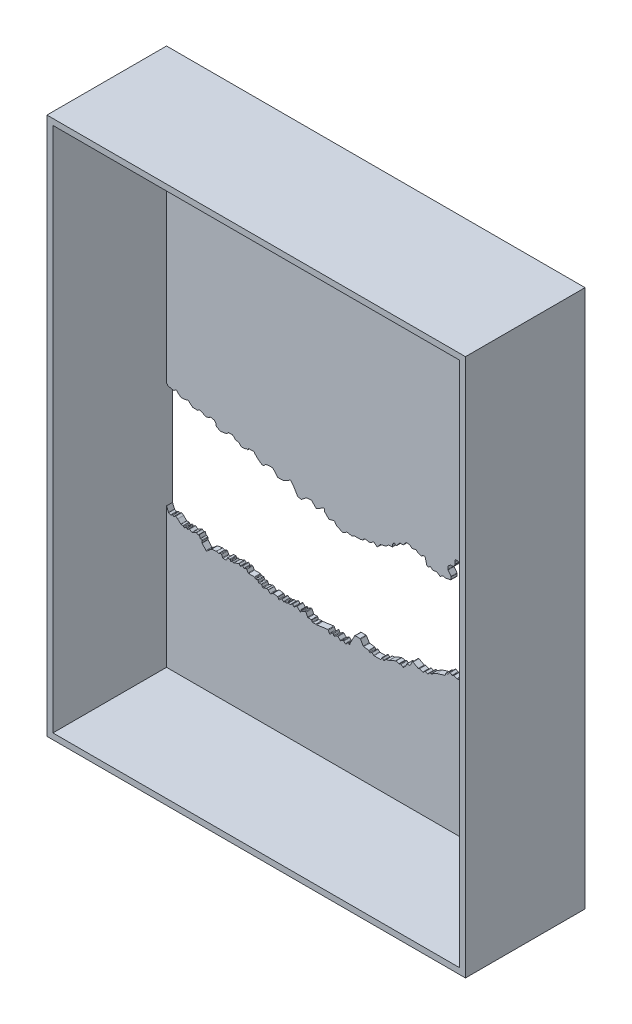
SolidWorks part; units mm, degrees
ref_plane "Plan de face" through (0, 0, 0) normal (0, 0, 1) x (1, 0, 0)
ref_plane "Plan de dessus" through (0, 0, 0) normal (0, 1, 0) x (1, 0, 0)
ref_plane "Plan de droite" through (0, 0, 0) normal (1, 0, 0) x (0, 0, -1)
sketch "Esquisse2" plane through (0, 0, 0) normal (0, 0, 1) x (1, 0, 0)
  line L1 (-700, -900) -> (700, -900)
  line L2 (-700, -900) -> (-700, 900)
  line L3 (-700, 900) -> (700, 900)
  line L4 (700, -900) -> (700, 900)
  line L5 (-700, -900) -> (700, 900) construction
  line L6 (-700, 900) -> (700, -900) construction
  point P0 (0, 0)
  dimension "D1" = 1400
  dimension "D2" = 1800
extrude "Boss.-Extru.2" add sketch "Esquisse2" along normal mid plane 400
shell "Coque1" thickness 20
sketch "Esquisse3" plane through (0, 0, -200) normal (0, 0, -1) x (-1, 0, 0)
  line L0 (-680, -103.7148) -> (-680, -442.1526)
  line L1 (680, -57.3161) -> (680, -412.1299)
  line L2 (-700, -900) -> (-700, 900) construction
  line L3 (700, 900) -> (700, -900) construction
  line L4 (-680, -103.7148) -> (-654.5429, -114.7682)
  line L5 (-571.1489, -108.8852) -> (-562.3972, -114.4682)
  line L6 (-560.2481, -114.5045) -> (-551.366, -109.2518)
  line L7 (-582.8883, -114.5204) -> (-573.298, -108.8489)
  line L8 (-506.7255, -126.8592) -> (-495.7181, -129.6027)
  line L9 (-494.6752, -130.2364) -> (-490.8979, -134.5174)
  line L10 (-394.3767, -118.0774) -> (-390.4085, -120.9941)
  line L11 (-400.3667, -119.7797) -> (-396.4939, -117.8871)
  line L12 (-388.8827, -121.3693) -> (-382.4669, -120.3894)
  line L13 (-358.7974, -71.7411) -> (-351.5781, -70.2973)
  line L14 (59.9419, -189.6992) -> (75.24, -186.5564)
  line L15 (76.6604, -186.7785) -> (89.855, -194.2083)
  line L16 (-350.3579, -70.4273) -> (-337.4728, -76.0219)
  line L17 (-336.2526, -76.1519) -> (-326.9595, -74.2933)
  line L18 (-54.181, -161.718) -> (-35.3279, -166.6844)
  line L19 (-34.2404, -167.3965) -> (-26.0797, -177.7202)
  line L20 (-23.1962, -178.0576) -> (-14.341, -171.0579)
  line L21 (-11.9292, -170.9603) -> (-0.7128, -178.4379)
  line L22 (0.8391, -178.7407) -> (12.6631, -176.3116)
  line L23 (91.7458, -194.2725) -> (112.1043, -184.5649)
  line L24 (113.0095, -183.7192) -> (117.4097, -175.9048)
  line L25 (-270.0973, -151.0215) -> (-254.4318, -154.7954)
  line L26 (119.7215, -174.9269) -> (135.5622, -179.0998)
  line L27 (137.5529, -178.55) -> (151.0177, -164.7823)
  line L28 (151.6029, -163.3469) -> (151.6029, -157.3846)
  line L29 (154.689, -155.6106) -> (168.9714, -163.9283)
  line L30 (168.9714, -163.9283) -> (177.7168, -169.0214)
  line L31 (180.2176, -168.6828) -> (188.9423, -159.7619)
  line L32 (188.9423, -159.7619) -> (193.0823, -154.5842)
  line L33 (194.6857, -153.8134) -> (206.4382, -153.8134)
  line L34 (206.4382, -153.8134) -> (211.7402, -154.8063)
  line L35 (212.6444, -155.2207) -> (228.3905, -167.8113)
  line L36 (230.0918, -168.2176) -> (240.4975, -166.0468)
  line L37 (241.8522, -165.0703) -> (252.6886, -146.463)
  line L38 (252.6886, -146.463) -> (255.7463, -141.2127)
  line L39 (255.7463, -141.2127) -> (264.1303, -130.7273)
  line L40 (267.0158, -130.406) -> (272.7768, -135.0125)
  line L41 (273.1982, -135.2729) -> (291.7269, -143.8294)
  line L42 (291.7269, -143.8294) -> (291.7375, -143.8378)
  line L43 (291.7375, -143.8378) -> (302.2614, -143.8378)
  line L44 (-652.819, -114.7272) -> (-638.9796, -107.9184)
  line L45 (-636.2313, -108.8541) -> (-633.6996, -113.9999)
  line L46 (-631.8576, -115.1466) -> (-623.2296, -115.1466)
  line L47 (-621.778, -114.5453) -> (-611.5488, -104.3161)
  line L48 (-610.0971, -103.7148) -> (-600.7213, -103.7148)
  line L49 (-599.2696, -104.3161) -> (-595.5538, -108.0319)
  line L50 (-595.1674, -108.3352) -> (-584.9986, -114.5083)
  line L51 (-548.554, -109.9739) -> (-542.1719, -120.7657)
  line L52 (-540.9154, -121.7092) -> (-529.6501, -124.6017)
  line L53 (-528.3936, -125.5452) -> (-524.2993, -132.4685)
  line L54 (-522.5322, -133.4764) -> (-515.6008, -133.4764)
  line L55 (-514.1491, -132.8752) -> (-508.6736, -127.3996)
  line L56 (-488.9077, -135.1619) -> (-481.6506, -133.5285)
  line L57 (-481.206, -133.373) -> (-474.6103, -130.1762)
  line L58 (-473.5137, -128.8253) -> (-472.0621, -123.0011)
  line L59 (-470.9655, -121.6502) -> (-468.8396, -120.6198)
  line L60 (-467.271, -120.5277) -> (-457.9632, -123.7583)
  line L61 (-381.5038, -119.9705) -> (-376.718, -116.1875)
  line L62 (-455.5465, -122.9026) -> (-451.5922, -116.5404)
  line L63 (-449.1755, -115.6847) -> (-444.8973, -117.1696)
  line L64 (-442.8659, -116.7695) -> (-437.6627, -112.1785)
  line L65 (-434.7651, -112.3596) -> (-433.7617, -113.4968)
  line L66 (-432.2223, -114.1914) -> (-431.5133, -114.1914)
  line L67 (-430.6179, -113.9859) -> (-423.6899, -110.628)
  line L68 (-421.7108, -110.7317) -> (-417.7507, -113.1931)
  line L69 (-417.295, -113.5784) -> (-414.2023, -117.0835)
  line L70 (-413.1594, -117.7172) -> (-404.1052, -119.9739)
  line L71 (-403.5678, -120.0344) -> (-401.2272, -119.9878)
  line L72 (-376.718, -116.1875) -> (-373.2721, -113.4636)
  line L73 (-372.4923, -111.8531) -> (-372.4923, -109.065)
  line L74 (-370.4394, -107.0121) -> (-370.385, -107.0121)
  line L75 (-370.385, -107.0121) -> (-365.704, -103.3119)
  line L76 (-364.9918, -102.2243) -> (-363.7477, -97.5015)
  line L77 (-364.1224, -95.7055) -> (-366.5109, -92.6839)
  line L78 (-366.5109, -92.6839) -> (-368.8508, -89.7238)
  line L79 (-368.8944, -87.2349) -> (-368.1661, -86.244)
  line L80 (-365.8578, -85.1433) -> (-368.1661, -86.244)
  line L81 (-364.7562, -83.8132) -> (-363.729, -79.9136)
  line L82 (-362.6274, -78.5835) -> (-361.7793, -78.1792)
  line L83 (-360.6137, -76.4495) -> (-360.444, -73.6308)
  line L84 (-325.341, -74.6522) -> (-320.6499, -78.1002)
  line L85 (-312.7291, -77.0942) -> (-308.5398, -85.8799)
  line L86 (-306.3768, -87.0257) -> (-288.1651, -84.2442)
  line L87 (-285.8258, -85.9636) -> (-284.7994, -92.6839)
  line L88 (-284.7994, -92.6839) -> (-284.7994, -99.234)
  line L89 (-284.5995, -100.1176) -> (-281.7217, -106.1529)
  line L90 (-280.3916, -107.2545) -> (-274.4935, -108.8083)
  line L91 (-273.9705, -108.876) -> (-270.7706, -108.876)
  line L92 (-269.5548, -109.2747) -> (-262.3507, -114.5698)
  line L93 (-261.5136, -116.2239) -> (-261.5136, -125.9051)
  line L94 (-261.9124, -127.1209) -> (-266.5838, -133.4764)
  line L95 (-266.5838, -133.4764) -> (-271.7681, -140.5299)
  line L96 (-272.1669, -141.7457) -> (-272.1669, -148.9686)
  line L97 (-270.1139, -151.0215) -> (-270.0973, -151.0215)
  line L98 (-210.608, -153.1983) -> (-203.1716, -147.32)
  line L99 (-200.288, -147.6575) -> (-198.2452, -150.2417)
  line L100 (-196.6347, -151.0215) -> (-192.6345, -151.0215)
  line L101 (-190.6493, -149.4915) -> (-187.431, -137.2744)
  line L102 (-187.431, -137.2744) -> (-185.0164, -128.1084)
  line L103 (-183.0312, -126.5784) -> (-177.9261, -126.5784)
  line L104 (-176.3156, -127.3582) -> (-173.3405, -131.1219)
  line L105 (-170.8464, -131.7018) -> (-160.1016, -126.5784)
  line L106 (-160.1016, -126.5784) -> (-154.9411, -122.4991)
  line L107 (-153.1451, -122.1244) -> (-142.8041, -124.8485)
  line L108 (-141.008, -124.4739) -> (-132.98, -118.1279)
  line L109 (-131.707, -117.6855) -> (-122.2607, -117.6855)
  line L110 (-120.6502, -118.4654) -> (-118.3323, -121.3976)
  line L111 (-118.3323, -121.3976) -> (-112.5499, -128.7127)
  line L112 (-110.9394, -129.4926) -> (-101.1256, -129.4926)
  line L113 (-99.5151, -130.2724) -> (-97.828, -132.4068)
  line L114 (-97.828, -132.4068) -> (-89.82, -142.5374)
  line L115 (-86.9364, -142.8749) -> (-82.7307, -139.5504)
  line L116 (-79.8471, -139.8879) -> (-76.9221, -143.5883)
  line L117 (-76.4797, -144.8614) -> (-76.4797, -151.7604)
  line L118 (-74.4268, -153.8134) -> (-63.4837, -153.8134)
  line L119 (-62.0483, -154.3986) -> (-55.0934, -161.2005)
  line L120 (302.2614, -143.8378) -> (307.3672, -143.8378)
  line L121 (308.9706, -143.067) -> (316.9799, -133.0503)
  line L122 (316.9799, -133.0503) -> (324.7071, -125.1493)
  line L123 (326.1747, -124.5318) -> (337.7105, -124.5318)
  line L124 (337.7105, -124.5318) -> (347.6912, -126.4009)
  line L125 (12.6631, -176.3116) -> (15.7566, -176.3116)
  line L126 (21.4949, -180.5108) -> (21.4949, -180.7676)
  line L127 (23.0248, -182.7528) -> (31.6301, -185.0196)
  line L128 (31.6301, -185.0196) -> (35.0532, -185.0196)
  line L129 (51.0745, -185.2837) -> (58.5215, -189.4771)
  line L130 (35.0532, -185.0196) -> (50.0672, -185.0196)
  line L131 (20.4751, -178.7368) -> (16.7897, -176.5905)
  line L132 (348.7487, -126.951) -> (354.3868, -132.4651)
  line L133 (355.8222, -133.0503) -> (360.8144, -133.0503)
  line L134 (362.0875, -132.6079) -> (377.5005, -120.4244)
  line L135 (377.5005, -120.4244) -> (385.1244, -112.6289)
  line L136 (385.7097, -111.1935) -> (385.7097, -110.9289)
  line L137 (387.7626, -108.876) -> (404.3401, -108.876)
  line L138 (406.393, -110.9289) -> (406.393, -111.8713)
  line L139 (414.6033, -113.6128) -> (416.3635, -115.3342)
  line L140 (417.7989, -115.9195) -> (429.3004, -115.9195)
  line L141 (438.1199, -107.7778) -> (445.6726, -106.2021)
  line L142 (449.7371, -104.9986) -> (454.9207, -99.6984)
  line L143 (454.9207, -99.6984) -> (459.0176, -96.6056)
  line L144 (474.0299, -97.0072) -> (476.0203, -99.6438)
  line L145 (479.5067, -102.5719) -> (494.6631, -105.4102)
  line L146 (495.041, -105.4453) -> (501.0858, -105.4453)
  line L147 (513.848, -96.8629) -> (513.848, -92.7175)
  line L148 (520.0338, -84.492) -> (514.3182, -91.41)
  line L149 (502.1546, -105.1452) -> (512.8637, -98.6157)
  line L150 (479.5067, -102.5719) -> (476.3586, -99.9956)
  line L151 (472.3914, -96.1912) -> (460.2545, -96.1912)
  line L152 (437.0181, -108.4087) -> (430.8215, -115.2453)
  line L153 (521.2033, -83.7887) -> (533.0942, -81.3459)
  line L154 (535.2601, -82.2881) -> (536.846, -84.8892)
  line L155 (538.0759, -85.8057) -> (546.8717, -88.1227)
  line L156 (548.2451, -88.006) -> (561.2374, -82.0927)
  line L157 (561.2374, -82.0927) -> (568.2671, -78.8931)
  line L158 (570.4177, -79.1729) -> (574.9475, -82.8799)
  line L159 (576.2885, -83.3437) -> (592.0225, -83.0303)
  line L160 (593.3275, -82.528) -> (604.1381, -73.1426)
  line L161 (604.1381, -73.1426) -> (606.7413, -70.8826)
  line L162 (608.6101, -70.4476) -> (620.6848, -73.6284)
  line L163 (621.2077, -73.6961) -> (630.8392, -73.6961)
  line L164 (632.0761, -73.2817) -> (642.8036, -65.1832)
  line L165 (643.1555, -64.8449) -> (645.7968, -61.6173)
  line L166 (648.4187, -61.1434) -> (655.9613, -65.5361)
  line L167 (657.4075, -65.773) -> (675.5844, -62.0388)
  line L168 (677.2242, -60.0279) -> (677.2242, -59.564)
  line L169 (678.8579, -57.5543) -> (680, -57.3161)
  line L170 (437.4664, -107.9141) -> (448.6887, -105.5729)
  line L171 (408.8652, -113.881) -> (412.7487, -113.0708)
  line L172 (272.9717, -135.1683) -> (291.7269, -143.8294)
  line L173 (-253.5543, -154.8138) -> (-244.9814, -153.1254)
  line L174 (-243.4409, -153.4348) -> (-236.5939, -158.0286)
  line L175 (-234.3514, -158.058) -> (-223.9743, -151.4834)
  line L176 (-222.4052, -151.2193) -> (-212.3515, -153.5861)
  line L177 (-318.2193, -78.1009) -> (-315.7969, -76.3228)
  line L178 (-680, -442.1526) -> (-667.3903, -434.8785)
  line L179 (228.598, -488.4713) -> (227.4469, -490.4512)
  line L182 (-610.5326, -444.4828) -> (-607.3928, -445.4488)
  line L183 (-594.3656, -441.497) -> (-590.8521, -438.1777)
  line L184 (-588.0248, -438.2581) -> (-586.0429, -440.356)
  line L185 (-576.2798, -443.4207) -> (-567.957, -441.3078)
  line L186 (-565.5263, -442.7541) -> (-565.4036, -443.2377)
  line L188 (-541.3731, -439.048) -> (-540.8387, -438.5432)
  line L189 (-537.7328, -438.9976) -> (-535.7504, -442.4343)
  line L198 (-439.8047, -443.3257) -> (-439.031, -442.8794)
  line L199 (-436.5779, -443.2384) -> (-432.9044, -447.1267)
  line L201 (-407.2937, -440.6016) -> (-406.7135, -438.7158)
  line L202 (-404.2138, -437.3924) -> (-385.8724, -443.0354)
  line L203 (-384.4605, -444.9469) -> (-384.4605, -447.5796)
  line L205 (-362.6296, -448.8704) -> (-360.8349, -445.7833)
  line L206 (-357.652, -445.4151) -> (-355.5465, -447.6438)
  line L207 (-343.7339, -449.8532) -> (-336.2526, -445.5375)
  line L208 (-336.2526, -445.5375) -> (-335.4491, -446.388)
  line L209 (-319.6094, -447.6368) -> (-314.8517, -442.0463)
  line L210 (-304.9045, -430.3579) -> (-301.3862, -426.2236)
  line L211 (-299.275, -425.6082) -> (-294.1328, -427.1903)
  line L212 (-275.125, -425.1071) -> (-268.3513, -421.5208)
  line L213 (-265.648, -422.3525) -> (-262.6335, -428.0462)
  line L214 (-250.9887, -437.6088) -> (-222.8756, -446.2581)
  line L215 (-222.8756, -446.2581) -> (-205.7836, -456.1949)
  line L216 (-161.8689, -461.8894) -> (-144.5716, -452.7314)
  line L217 (-141.8682, -453.5631) -> (-134.906, -466.7132)
  line L223 (21.9964, -489.4596) -> (31.0517, -473.8838)
  line L224 (32.7808, -472.889) -> (48.8631, -472.889)
  line L225 (50.6306, -473.9532) -> (66.2683, -503.489)
  line L226 (66.5007, -504.4249) -> (66.5007, -505.8058)
  line L230 (228.598, -488.4713) -> (230.0918, -487.6804)
  line L232 (273.3819, -490.0806) -> (278.8788, -493.2763)
  line L233 (281.613, -492.5525) -> (281.6578, -492.4756)
  line L234 (324.6629, -487.8745) -> (330.6684, -492.9853)
  line L235 (333.4877, -492.7584) -> (339.3374, -485.8847)
  line L243 (530.3093, -463.0485) -> (545.3486, -475.8473)
  line L244 (548.1679, -475.6204) -> (560.7605, -460.8234)
  line L245 (561.2374, -459.5272) -> (561.2374, -454.5344)
  line L252 (673.3152, -427.8) -> (680, -412.1299)
  line L253 (672.4848, -428.742) -> (667.1525, -431.8587)
  line L254 (665.0873, -431.8306) -> (660.6063, -429.0449)
  line L255 (658.5412, -429.0168) -> (655.8093, -430.6135)
  line L256 (653.0734, -429.8961) -> (651.829, -427.7671)
  line L257 (649.0121, -427.0996) -> (642.9676, -431.0296)
  line L258 (642.6634, -431.2726) -> (632.6583, -441.0025)
  line L259 (631.264, -441.5687) -> (625.2103, -441.5687)
  line L260 (623.4813, -442.5635) -> (622.2129, -444.7452)
  line L261 (619.4787, -445.469) -> (614.4989, -442.5739)
  line L262 (611.7647, -443.2977) -> (611.2429, -444.1952)
  line L263 (608.0801, -444.5843) -> (605.2841, -441.7092)
  line L264 (602.7601, -441.4268) -> (595.277, -446.2922)
  line L265 (592.3659, -445.4426) -> (592.3439, -445.3943)
  line L266 (591.3077, -444.3818) -> (581.5126, -440.2032)
  line L267 (579.6376, -440.3661) -> (574.6692, -443.5965)
  line L268 (571.9023, -443.01) -> (570.8006, -441.3156)
  line L269 (570.8006, -441.3156) -> (567.0911, -450.0111)
  line L270 (566.0786, -451.0473) -> (562.4103, -452.7135)
  line L272 (529.2937, -462.5914) -> (513.299, -460.3247)
  line L273 (512.4428, -460.3895) -> (505.5386, -462.4642)
  line L274 (504.1783, -462.3884) -> (498.3637, -459.908)
  line L275 (495.7394, -460.9628) -> (492.5418, -468.4583)
  line L276 (490.7022, -469.6735) -> (480.994, -469.6735)
  line L277 (479.0786, -468.2491) -> (477.2977, -462.3224)
  line L278 (475.3823, -460.898) -> (468.8231, -460.898)
  line L279 (466.9835, -462.1132) -> (466.0389, -464.3274)
  line L280 (462.5226, -464.6328) -> (461.9993, -463.8279)
  line L281 (459.2323, -463.2414) -> (456.5144, -465.0085)
  line L282 (454.6395, -465.1714) -> (439.4949, -458.7108)
  line L283 (437.3158, -459.1166) -> (433.7382, -462.5957)
  line L284 (430.9101, -462.5563) -> (427.8341, -459.3933)
  line L285 (425.006, -459.3538) -> (421.1931, -463.0618)
  line L286 (419.014, -463.4676) -> (414.0299, -461.3415)
  line L287 (411.5161, -462.1758) -> (406.9714, -469.9931)
  line L288 (405.2423, -470.9879) -> (386.2751, -470.9879)
  line L289 (384.5461, -471.9827) -> (383.2733, -474.1719)
  line L290 (381.2637, -475.1469) -> (376.1028, -474.4156)
  line L291 (373.9826, -475.611) -> (372.0943, -480.0375)
  line L292 (369.974, -481.2329) -> (363.6059, -480.3305)
  line L293 (361.4857, -481.5259) -> (358.9585, -487.45)
  line L294 (356.3342, -488.5048) -> (345.9125, -484.059)
  line L295 (344.5522, -483.9832) -> (340.2849, -485.2655)
  line L296 (323.1301, -487.4117) -> (308.5162, -489.1527)
  line L297 (306.9132, -490.3539) -> (305.1056, -494.5911)
  line L298 (301.8322, -495.2007) -> (296.1405, -489.3479)
  line L299 (293.3124, -489.3085) -> (288.9935, -493.5086)
  line L300 (286.1653, -493.4692) -> (284.8206, -492.0864)
  line L301 (271.8011, -489.8942) -> (266.8966, -491.3681)
  line L302 (264.8872, -490.847) -> (261.0187, -486.8691)
  line L303 (258.1905, -486.8297) -> (254.1224, -490.7859)
  line L304 (251.2943, -490.7464) -> (246.1448, -485.4513)
  line L305 (243.3167, -485.4119) -> (233.4862, -494.9719)
  line L306 (230.0918, -493.5381) -> (230.0918, -487.6804)
  line L308 (224.7127, -491.175) -> (216.0631, -486.1464)
  line L309 (213.241, -487.0393) -> (207.9587, -498.5183)
  line L310 (206.1418, -499.6823) -> (195.9669, -499.6823)
  line L311 (194.1501, -500.8462) -> (192.1521, -505.1879)
  line L312 (190.0546, -506.3321) -> (180.2176, -504.938)
  line L313 (180.2176, -504.938) -> (177.7168, -505.6951)
  line L314 (177.7168, -505.6951) -> (140.6426, -500.4412)
  line L315 (138.5451, -501.5854) -> (135.1164, -509.0362)
  line L316 (131.8657, -509.5945) -> (125.801, -503.3582)
  line L317 (122.5503, -503.9165) -> (120.6413, -508.065)
  line L318 (117.8192, -508.958) -> (108.8204, -503.7263)
  line L319 (106.4208, -504.0215) -> (99.1302, -511.1116)
  line L320 (96.7306, -511.4068) -> (89.626, -507.2764)
  line L321 (87.2265, -507.5716) -> (82.4963, -512.1716)
  line L322 (79.6682, -512.1322) -> (73.8669, -506.1668)
  line L323 (71.0387, -506.1273) -> (69.8951, -507.2396)
  line L330 (20.504, -490.4403) -> (3.9609, -492.4112)
  line L331 (2.4684, -493.3919) -> (0.7539, -496.341)
  line L332 (-2.4089, -496.7302) -> (-5.1, -493.963)
  line L333 (-7.9281, -493.9236) -> (-12.8318, -498.6924)
  line L334 (-14.2262, -499.2586) -> (-35.8588, -499.2586)
  line L335 (-37.773, -497.8381) -> (-39.096, -493.468)
  line L336 (-42.4045, -492.6137) -> (-45.8973, -496.0104)
  line L337 (-48.7254, -495.9709) -> (-54.6169, -489.9128)
  line L338 (-55.7701, -489.3269) -> (-63.7561, -488.1952)
  line L339 (-64.3116, -488.0318) -> (-76.4797, -482.4324)
  line L340 (-76.4797, -482.4324) -> (-86.247, -477.9377)
  line L341 (-87.6626, -477.8403) -> (-97.1017, -480.6979)
  line L342 (-98.5173, -480.6005) -> (-102.6567, -478.6957)
  line L343 (-104.7218, -478.9347) -> (-110.7156, -483.6032)
  line L344 (-113.3783, -483.4197) -> (-120.3108, -476.2911)
  line L345 (-120.7912, -475.4763) -> (-122.692, -469.1979)
  line L346 (-124.6062, -467.7774) -> (-131.707, -467.7774)
  line L347 (-131.707, -467.7774) -> (-133.1384, -467.7774)
  line L350 (-164.2386, -461.5162) -> (-164.4767, -461.2712)
  line L351 (-166.7376, -460.8446) -> (-176.6457, -465.3449)
  line L352 (-178.9066, -464.9183) -> (-184.0359, -459.6438)
  line L353 (-186.2968, -459.2172) -> (-192.8823, -462.2084)
  line L354 (-195.2873, -461.6164) -> (-199.4445, -456.2791)
  line L355 (-201.6018, -455.5939) -> (-204.1989, -456.3801)
  line L360 (-252.3148, -436.2767) -> (-254.0543, -430.5308)
  line L361 (-255.9685, -429.1104) -> (-260.8659, -429.1104)
  line L362 (-277.0661, -425.0686) -> (-279.6395, -423.5725)
  line L363 (-281.2242, -423.3873) -> (-292.0816, -426.6742)
  line L364 (-292.0816, -426.6742) -> (-292.3157, -426.8566)
  line L365 (-307.4329, -430.7907) -> (-308.6616, -430.0763)
  line L366 (-311.3958, -430.8002) -> (-315.0735, -437.126)
  line L367 (-314.9223, -439.3602) -> (-314.7969, -439.5211)
  line L368 (-320.553, -448.2549) -> (-325.7242, -449.8204)
  line L369 (-327.3089, -449.6352) -> (-334.3573, -445.5375)
  line L370 (-334.3573, -445.5375) -> (-335.4491, -446.388)
  line L371 (-345.7385, -449.8499) -> (-350.1218, -447.3015)
  line L372 (-352.356, -447.4527) -> (-352.8637, -447.8482)
  line L373 (-365.3639, -449.5942) -> (-367.1722, -448.5429)
  line L374 (-369.8759, -449.216) -> (-372.0168, -452.6599)
  line L375 (-374.5514, -453.4208) -> (-383.2966, -449.3965)
  line L377 (-407.2937, -440.6016) -> (-408.9231, -439.2149)
  line L378 (-410.7988, -438.8238) -> (-421.9333, -442.1946)
  line L379 (-423.1707, -443.2727) -> (-424.9991, -447.2461)
  line L380 (-427.0966, -448.3903) -> (-431.7312, -447.7335)
  line L381 (-442.1003, -443.1164) -> (-445.9505, -439.8398)
  line L382 (-448.7698, -440.0667) -> (-451.7458, -443.5636)
  line L383 (-453.5495, -444.2476) -> (-467.9442, -442.2077)
  line L384 (-467.9442, -442.2077) -> (-474.6103, -442.2077)
  line L385 (-474.6103, -442.2077) -> (-480.6733, -442.2077)
  line L386 (-482.2512, -441.4367) -> (-484.6304, -438.3821)
  line L387 (-487.4372, -438.0332) -> (-491.8369, -441.4601)
  line L388 (-493.9019, -441.6991) -> (-505.4051, -436.4057)
  line L389 (-508.058, -437.3864) -> (-509.8937, -441.3756)
  line L390 (-512.7665, -442.2381) -> (-519.4763, -438.0669)
  line L391 (-522.5322, -439.7655) -> (-522.5322, -441.4349)
  line L392 (-524.5322, -443.4349) -> (-534.0179, -443.4349)
  line L393 (-543.8024, -439.2927) -> (-547.6456, -436.9036)
  line L394 (-549.9305, -437.0243) -> (-556.5831, -442.2059)
  line L395 (-559.39, -441.857) -> (-559.7624, -441.3789)
  line L396 (-562.5692, -441.03) -> (-565.4036, -443.2377)
  line L397 (-577.8278, -443.1807) -> (-582.8883, -440.0349)
  line L398 (-582.8883, -440.0349) -> (-582.8905, -440.0385)
  line L399 (-596.7949, -441.7417) -> (-598.0851, -440.9396)
  line L400 (-600.37, -441.0603) -> (-605.5757, -445.115)
  line L401 (-611.5223, -443.8002) -> (-615.2355, -439.0329)
  line L402 (-617.6404, -438.4409) -> (-627.0137, -442.6983)
  line L403 (-627.6042, -442.8633) -> (-641.1396, -444.4758)
  line L404 (-643.3762, -442.4899) -> (-643.3762, -439.9093)
  line L405 (-646.2033, -438.0884) -> (-658.0108, -443.4514)
  line L406 (-660.5661, -442.6371) -> (-664.6628, -435.6042)
  arc A0 (621.2077, -73.6961) -> (620.6848, -73.6284) centre (621.2077, -71.6432) cw
  arc A1 (630.8392, -73.6961) -> (632.0761, -73.2817) centre (630.8392, -71.6432) ccw
  arc A2 (642.8036, -65.1832) -> (643.1555, -64.8449) centre (641.5667, -63.5448) ccw
  arc A3 (657.4075, -65.773) -> (655.9613, -65.5361) centre (656.9944, -63.762) cw
  arc A4 (677.2242, -59.564) -> (678.8579, -57.5543) centre (679.2772, -59.564) cw
  arc A5 (675.5844, -62.0388) -> (677.2242, -60.0279) centre (675.1713, -60.0279) ccw
  arc A6 (645.7968, -61.6173) -> (648.4187, -61.1434) centre (647.3856, -62.9175) cw
  arc A7 (606.7413, -70.8826) -> (608.6101, -70.4476) centre (608.0871, -72.4328) cw
  arc A8 (592.0225, -83.0303) -> (593.3275, -82.528) centre (591.9817, -80.9778) ccw
  arc A9 (574.9475, -82.8799) -> (576.2885, -83.3437) centre (576.2476, -81.2911) ccw
  arc A10 (568.2671, -78.8931) -> (570.4177, -79.1729) centre (569.1175, -80.7616) cw
  arc A11 (546.8717, -88.1227) -> (548.2451, -88.006) centre (547.3947, -86.1375) ccw
  arc A12 (536.846, -84.8892) -> (538.0759, -85.8057) centre (538.5988, -83.8205) ccw
  arc A13 (533.0942, -81.3459) -> (535.2601, -82.2881) centre (533.5073, -83.3568) cw
  arc A14 (520.0338, -84.492) -> (521.2033, -83.7887) centre (521.6165, -85.7996) cw
  arc A15 (513.848, -92.7175) -> (514.3182, -91.41) centre (515.9009, -92.7175) cw
  arc A16 (513.848, -96.8629) -> (512.8637, -98.6157) centre (511.795, -96.8629) cw
  arc A17 (501.0858, -105.4453) -> (502.1546, -105.1452) centre (501.0858, -103.3924) ccw
  arc A18 (494.6631, -105.4102) -> (495.041, -105.4453) centre (495.041, -103.3924) ccw
  arc A19 (476.0203, -99.6438) -> (476.3586, -99.9956) centre (477.6588, -98.4069) ccw
  arc A20 (474.0299, -97.0072) -> (472.3914, -96.1912) centre (472.3914, -98.2441) ccw
  arc A21 (459.0176, -96.6056) -> (460.2545, -96.1912) centre (460.2545, -98.2441) cw
  arc A22 (449.7371, -104.9986) -> (448.6887, -105.5729) centre (448.2694, -103.5632) cw
  arc A23 (438.1199, -107.7778) -> (437.0181, -108.4087) centre (438.5391, -109.7874) ccw
  arc A24 (429.3004, -115.9195) -> (430.8215, -115.2453) centre (429.3004, -113.8666) ccw
  arc A25 (347.6912, -126.4009) -> (348.7487, -126.951) centre (347.3133, -128.4187) cw
  arc A26 (354.3868, -132.4651) -> (355.8222, -133.0503) centre (355.8222, -130.9974) ccw
  arc A27 (360.8144, -133.0503) -> (362.0875, -132.6079) centre (360.8144, -130.9974) ccw
  arc A28 (385.1244, -112.6289) -> (385.7097, -111.1935) centre (383.6568, -111.1935) ccw
  arc A29 (416.3635, -115.3342) -> (417.7989, -115.9195) centre (417.7989, -113.8666) ccw
  arc A30 (414.6033, -113.6128) -> (412.7487, -113.0708) centre (413.1679, -115.0804) ccw
  arc A31 (406.393, -111.8713) -> (408.8652, -113.881) centre (408.4459, -111.8713) ccw
  arc A32 (404.3401, -108.876) -> (406.393, -110.9289) centre (404.3401, -110.9289) cw
  arc A33 (385.7097, -110.9289) -> (387.7626, -108.876) centre (387.7626, -110.9289) cw
  arc A34 (324.7071, -125.1493) -> (326.1747, -124.5318) centre (326.1747, -126.5847) cw
  arc A35 (307.3672, -143.8378) -> (308.9706, -143.067) centre (307.3672, -141.7849) ccw
  arc A36 (272.7768, -135.0125) -> (273.1982, -135.2729) centre (274.0589, -133.4091) ccw
  arc A37 (264.1303, -130.7273) -> (267.0158, -130.406) centre (265.7337, -132.0093) cw
  arc A38 (240.4975, -166.0468) -> (241.8522, -165.0703) centre (240.0782, -164.0371) ccw
  arc A39 (228.3905, -167.8113) -> (230.0918, -168.2176) centre (229.6726, -166.208) ccw
  arc A40 (211.7402, -154.8063) -> (212.6444, -155.2207) centre (211.3623, -156.8241) cw
  arc A41 (193.0823, -154.5842) -> (194.6857, -153.8134) centre (194.6857, -155.8663) cw
  arc A42 (177.7168, -169.0214) -> (180.2176, -168.6828) centre (178.7499, -167.2474) ccw
  arc A43 (154.689, -155.6106) -> (151.6029, -157.3846) centre (153.6559, -157.3846) ccw
  arc A44 (151.0177, -164.7823) -> (151.6029, -163.3469) centre (149.55, -163.3469) ccw
  arc A45 (135.5622, -179.0998) -> (137.5529, -178.55) centre (136.0852, -177.1146) ccw
  arc A46 (0.8391, -178.7407) -> (-0.7128, -178.4379) centre (0.426, -176.7298) cw
  arc A47 (21.4949, -180.5108) -> (20.4751, -178.7368) centre (19.4419, -180.5108) ccw
  arc A48 (15.7566, -176.3116) -> (16.7897, -176.5905) centre (15.7566, -178.3645) cw
  arc A49 (21.4949, -180.7676) -> (23.0248, -182.7528) centre (23.5478, -180.7676) ccw
  arc A50 (51.0745, -185.2837) -> (50.0672, -185.0196) centre (50.0672, -187.0726) ccw
  arc A51 (58.5215, -189.4771) -> (59.9419, -189.6992) centre (59.5287, -187.6883) ccw
  arc A52 (75.24, -186.5564) -> (76.6604, -186.7785) centre (75.6531, -188.5673) cw
  arc A53 (89.855, -194.2083) -> (91.7458, -194.2725) centre (90.8622, -192.4194) ccw
  arc A54 (112.1043, -184.5649) -> (113.0095, -183.7192) centre (111.2207, -182.7119) ccw
  arc A55 (117.4097, -175.9048) -> (119.7215, -174.9269) centre (119.1985, -176.9121) cw
  arc A56 (-14.341, -171.0579) -> (-11.9292, -170.9603) centre (-13.068, -172.6684) cw
  arc A57 (-26.0797, -177.7202) -> (-23.1962, -178.0576) centre (-24.4692, -176.4471) ccw
  arc A58 (-35.3279, -166.6844) -> (-34.2404, -167.3965) centre (-35.8509, -168.6696) cw
  arc A59 (-54.181, -161.718) -> (-55.0934, -161.2005) centre (-53.658, -159.7328) cw
  arc A60 (-63.4837, -153.8134) -> (-62.0483, -154.3986) centre (-63.4837, -155.8663) cw
  arc A61 (-89.82, -142.5374) -> (-86.9364, -142.8749) centre (-88.2094, -141.2644) ccw
  arc A62 (-82.7307, -139.5504) -> (-79.8471, -139.8879) centre (-81.4577, -141.161) cw
  arc A63 (-76.9221, -143.5883) -> (-76.4797, -144.8614) centre (-78.5326, -144.8614) cw
  arc A64 (-76.4797, -151.7604) -> (-74.4268, -153.8134) centre (-74.4268, -151.7604) ccw
  arc A65 (-101.1256, -129.4926) -> (-99.5151, -130.2724) centre (-101.1256, -131.5455) cw
  arc A66 (-112.5499, -128.7127) -> (-110.9394, -129.4926) centre (-110.9394, -127.4397) ccw
  arc A67 (-122.2607, -117.6855) -> (-120.6502, -118.4654) centre (-122.2607, -119.7385) cw
  arc A68 (-132.98, -118.1279) -> (-131.707, -117.6855) centre (-131.707, -119.7385) cw
  arc A69 (-142.8041, -124.8485) -> (-141.008, -124.4739) centre (-142.2811, -122.8633) ccw
  arc A70 (-154.9411, -122.4991) -> (-153.1451, -122.1244) centre (-153.668, -124.1096) cw
  arc A71 (-177.9261, -126.5784) -> (-176.3156, -127.3582) centre (-177.9261, -128.6313) cw
  arc A72 (-173.3405, -131.1219) -> (-170.8464, -131.7018) centre (-171.73, -129.8488) ccw
  arc A73 (-185.0164, -128.1084) -> (-183.0312, -126.5784) centre (-183.0312, -128.6313) cw
  arc A74 (-192.6345, -151.0215) -> (-190.6493, -149.4915) centre (-192.6345, -148.9686) ccw
  arc A75 (-198.2452, -150.2417) -> (-196.6347, -151.0215) centre (-196.6347, -148.9686) ccw
  arc A76 (-203.1716, -147.32) -> (-200.288, -147.6575) centre (-201.8985, -148.9305) cw
  arc A77 (-212.3515, -153.5861) -> (-210.608, -153.1983) centre (-211.8811, -151.5878) ccw
  arc A78 (-223.9743, -151.4834) -> (-222.4052, -151.2193) centre (-222.8756, -153.2176) cw
  arc A79 (-236.5939, -158.0286) -> (-234.3514, -158.058) centre (-235.4501, -156.3238) ccw
  arc A80 (-244.9814, -153.1254) -> (-243.4409, -153.4348) centre (-244.5847, -155.1396) cw
  arc A81 (-254.4318, -154.7954) -> (-253.5543, -154.8138) centre (-253.951, -152.7996) ccw
  arc A82 (-272.1669, -148.9686) -> (-270.1139, -151.0215) centre (-270.1139, -148.9686) ccw
  arc A83 (-271.7681, -140.5299) -> (-272.1669, -141.7457) centre (-270.1139, -141.7457) ccw
  arc A84 (-261.5136, -125.9051) -> (-261.9124, -127.1209) centre (-263.5666, -125.9051) cw
  arc A85 (-262.3507, -114.5698) -> (-261.5136, -116.2239) centre (-263.5666, -116.2239) cw
  arc A86 (-270.7706, -108.876) -> (-269.5548, -109.2747) centre (-270.7706, -110.9289) cw
  arc A87 (-274.4935, -108.8083) -> (-273.9705, -108.876) centre (-273.9705, -106.8231) ccw
  arc A88 (-284.7994, -99.234) -> (-284.5995, -100.1176) centre (-282.7465, -99.234) ccw
  arc A89 (-281.7217, -106.1529) -> (-280.3916, -107.2545) centre (-279.8686, -105.2693) ccw
  arc A90 (-288.1651, -84.2442) -> (-285.8258, -85.9636) centre (-287.8552, -86.2736) cw
  arc A91 (-308.5398, -85.8799) -> (-306.3768, -87.0257) centre (-306.6867, -84.9963) ccw
  arc A92 (-315.7969, -76.3228) -> (-312.7291, -77.0942) centre (-314.5821, -77.9777) cw
  arc A93 (-320.6499, -78.1002) -> (-318.2193, -78.1009) centre (-319.4341, -76.446) ccw
  arc A94 (-326.9595, -74.2933) -> (-325.341, -74.6522) centre (-326.5568, -76.3063) cw
  arc A95 (-351.5781, -70.2973) -> (-350.3579, -70.4273) centre (-351.1755, -72.3103) cw
  arc A96 (-337.4728, -76.0219) -> (-336.2526, -76.1519) centre (-336.6552, -74.1389) ccw
  arc A97 (-358.7974, -71.7411) -> (-360.444, -73.6308) centre (-358.3948, -73.7542) ccw
  arc A98 (-361.7793, -78.1792) -> (-360.6137, -76.4495) centre (-362.6629, -76.3261) ccw
  arc A99 (-363.729, -79.9136) -> (-362.6274, -78.5835) centre (-361.7438, -80.4366) cw
  arc A100 (-365.8578, -85.1433) -> (-364.7562, -83.8132) centre (-366.7414, -83.2903) ccw
  arc A101 (-368.8508, -89.7238) -> (-368.8944, -87.2349) centre (-367.2403, -88.4507) cw
  arc A102 (-363.7477, -97.5015) -> (-364.1224, -95.7055) centre (-365.7329, -96.9786) ccw
  arc A103 (-365.704, -103.3119) -> (-364.9918, -102.2243) centre (-366.977, -101.7013) ccw
  arc A104 (-372.4923, -109.065) -> (-370.4394, -107.0121) centre (-370.4394, -109.065) cw
  arc A105 (-373.2721, -113.4636) -> (-372.4923, -111.8531) centre (-374.5452, -111.8531) ccw
  arc A106 (-382.4669, -120.3894) -> (-381.5038, -119.9705) centre (-382.7769, -118.36) ccw
  arc A107 (-390.4085, -120.9941) -> (-388.8827, -121.3693) centre (-389.1926, -119.3399) ccw
  arc A108 (-396.4939, -117.8871) -> (-394.3767, -118.0774) centre (-395.5925, -119.7315) cw
  arc A109 (-401.2272, -119.9878) -> (-400.3667, -119.7797) centre (-401.2681, -117.9353) ccw
  arc A110 (-404.1052, -119.9739) -> (-403.5678, -120.0344) centre (-403.6087, -117.9819) ccw
  arc A111 (-414.2023, -117.0835) -> (-413.1594, -117.7172) centre (-412.6629, -115.7252) ccw
  arc A112 (-417.7507, -113.1931) -> (-417.295, -113.5784) centre (-418.8344, -114.9366) cw
  arc A113 (-423.6899, -110.628) -> (-421.7108, -110.7317) centre (-422.7945, -112.4753) cw
  arc A114 (-431.5133, -114.1914) -> (-430.6179, -113.9859) centre (-431.5133, -112.1385) ccw
  arc A115 (-433.7617, -113.4968) -> (-432.2223, -114.1914) centre (-432.2223, -112.1385) ccw
  arc A116 (-437.6627, -112.1785) -> (-434.7651, -112.3596) centre (-436.3044, -113.7178) cw
  arc A117 (-444.8973, -117.1696) -> (-442.8659, -116.7695) centre (-444.2241, -115.2302) ccw
  arc A118 (-451.5922, -116.5404) -> (-449.1755, -115.6847) centre (-449.8486, -117.6241) cw
  arc A119 (-457.9632, -123.7583) -> (-455.5465, -122.9026) centre (-457.2901, -121.8189) ccw
  arc A120 (-467.271, -120.5277) -> (-468.8396, -120.6198) centre (-467.9442, -122.4672) ccw
  arc A121 (-472.0621, -123.0011) -> (-470.9655, -121.6502) centre (-470.0701, -123.4976) cw
  arc A122 (-474.6103, -130.1762) -> (-473.5137, -128.8253) centre (-475.5057, -128.3288) ccw
  arc A123 (-481.6506, -133.5285) -> (-481.206, -133.373) centre (-482.1014, -131.5257) ccw
  arc A124 (-490.8979, -134.5174) -> (-488.9077, -135.1619) centre (-489.3585, -133.1591) ccw
  arc A125 (-495.7181, -129.6027) -> (-494.6752, -130.2364) centre (-496.2145, -131.5947) cw
  arc A126 (-508.6736, -127.3996) -> (-506.7255, -126.8592) centre (-507.2219, -128.8512) cw
  arc A127 (-515.6008, -133.4764) -> (-514.1491, -132.8752) centre (-515.6008, -131.4235) ccw
  arc A128 (-524.2993, -132.4685) -> (-522.5322, -133.4764) centre (-522.5322, -131.4235) ccw
  arc A129 (-529.6501, -124.6017) -> (-528.3936, -125.5452) centre (-530.1607, -126.5902) cw
  arc A130 (-542.1719, -120.7657) -> (-540.9154, -121.7092) centre (-540.4048, -119.7207) ccw
  arc A131 (-551.366, -109.2518) -> (-548.554, -109.9739) centre (-550.321, -111.0189) cw
  arc A132 (-562.3972, -114.4682) -> (-560.2481, -114.5045) centre (-561.2931, -112.7375) ccw
  arc A133 (-571.1489, -108.8852) -> (-573.298, -108.8489) centre (-572.253, -110.616) ccw
  arc A134 (-584.9986, -114.5083) -> (-582.8883, -114.5204) centre (-583.9333, -112.7534) ccw
  arc A135 (-595.5538, -108.0319) -> (-595.1674, -108.3352) centre (-594.1021, -106.5803) ccw
  arc A136 (-600.7213, -103.7148) -> (-599.2696, -104.3161) centre (-600.7213, -105.7677) cw
  arc A137 (-611.5488, -104.3161) -> (-610.0971, -103.7148) centre (-610.0971, -105.7677) cw
  arc A138 (-623.2296, -115.1466) -> (-621.778, -114.5453) centre (-623.2296, -113.0937) ccw
  arc A139 (-633.6996, -113.9999) -> (-631.8576, -115.1466) centre (-631.8576, -113.0937) ccw
  arc A140 (-638.9796, -107.9184) -> (-636.2313, -108.8541) centre (-638.0734, -109.7604) cw
  arc A141 (-652.819, -114.7272) -> (-654.5429, -114.7682) centre (-653.7253, -112.8851) cw
  arc A142 (622.2129, -444.7452) -> (619.4787, -445.469) centre (620.4839, -443.7399) cw
  arc A143 (625.2103, -441.5687) -> (623.4813, -442.5635) centre (625.2103, -443.5687) ccw
  arc A144 (632.6583, -441.0025) -> (631.264, -441.5687) centre (631.264, -439.5687) cw
  arc A145 (651.829, -427.7671) -> (649.0121, -427.0996) centre (650.1023, -428.7763) ccw
  arc A146 (642.9676, -431.0296) -> (642.6634, -431.2726) centre (644.0578, -432.7064) ccw
  arc A147 (655.8093, -430.6135) -> (653.0734, -429.8961) centre (654.8001, -428.8869) cw
  arc A148 (660.6063, -429.0449) -> (658.5412, -429.0168) centre (659.5504, -430.7435) ccw
  arc A149 (667.1525, -431.8587) -> (665.0873, -431.8306) centre (666.1433, -430.132) cw
  arc A150 (672.4848, -428.742) -> (673.3152, -427.8) centre (671.4756, -427.0153) ccw
  arc A151 (592.3439, -445.3943) -> (591.3077, -444.3818) centre (590.523, -446.2214) ccw
  arc A152 (605.2841, -441.7092) -> (602.7601, -441.4268) centre (603.8503, -443.1036) ccw
  arc A153 (611.2429, -444.1952) -> (608.0801, -444.5843) centre (609.5139, -443.19) cw
  arc A154 (614.4989, -442.5739) -> (611.7647, -443.2977) centre (613.4937, -444.3029) ccw
  arc A155 (595.277, -446.2922) -> (592.3659, -445.4426) centre (594.1868, -444.6155) cw
  arc A156 (505.5386, -462.4642) -> (504.1783, -462.3884) centre (504.9631, -460.5488) cw
  arc A157 (513.299, -460.3247) -> (512.4428, -460.3895) centre (513.0183, -462.3049) ccw
  arc A158 (530.3093, -463.0485) -> (529.2937, -462.5914) centre (529.0131, -464.5716) ccw
  arc A159 (498.3637, -459.908) -> (495.7394, -460.9628) centre (497.579, -461.7476) ccw
  arc A160 (562.4103, -452.7135) -> (561.2374, -454.5344) centre (563.2374, -454.5344) ccw
  arc A161 (574.6692, -443.5965) -> (571.9023, -443.01) centre (573.579, -441.9198) cw
  arc A162 (581.5126, -440.2032) -> (579.6376, -440.3661) centre (580.7278, -442.0428) ccw
  arc A163 (567.0911, -450.0111) -> (566.0786, -451.0473) centre (565.2515, -449.2263) cw
  arc A164 (560.7605, -460.8234) -> (561.2374, -459.5272) centre (559.2374, -459.5272) ccw
  arc A165 (545.3486, -475.8473) -> (548.1679, -475.6204) centre (546.6448, -474.3242) ccw
  arc A166 (406.9714, -469.9931) -> (405.2423, -470.9879) centre (405.2423, -468.9879) cw
  arc A167 (414.0299, -461.3415) -> (411.5161, -462.1758) centre (413.2451, -463.1811) ccw
  arc A168 (427.8341, -459.3933) -> (425.006, -459.3538) centre (426.4003, -460.7876) ccw
  arc A169 (421.1931, -463.0618) -> (419.014, -463.4676) centre (419.7987, -461.628) cw
  arc A170 (439.4949, -458.7108) -> (437.3158, -459.1166) centre (438.7101, -460.5504) ccw
  arc A171 (456.5144, -465.0085) -> (454.6395, -465.1714) centre (455.4242, -463.3318) cw
  arc A172 (461.9993, -463.8279) -> (459.2323, -463.2414) centre (460.3225, -464.9181) ccw
  arc A173 (433.7382, -462.5957) -> (430.9101, -462.5563) centre (432.3439, -461.1619) cw
  arc A174 (466.0389, -464.3274) -> (462.5226, -464.6328) centre (464.1993, -463.5426) cw
  arc A175 (477.2977, -462.3224) -> (475.3823, -460.898) centre (475.3823, -462.898) ccw
  arc A176 (480.994, -469.6735) -> (479.0786, -468.2491) centre (480.994, -467.6735) cw
  arc A177 (468.8231, -460.898) -> (466.9835, -462.1132) centre (468.8231, -462.898) ccw
  arc A178 (492.5418, -468.4583) -> (490.7022, -469.6735) centre (490.7022, -467.6735) cw
  arc A179 (358.9585, -487.45) -> (356.3342, -488.5048) centre (357.1189, -486.6652) cw
  arc A180 (363.6059, -480.3305) -> (361.4857, -481.5259) centre (363.3253, -482.3107) ccw
  arc A181 (372.0943, -480.0375) -> (369.974, -481.2329) centre (370.2547, -479.2527) cw
  arc A182 (383.2733, -474.1719) -> (381.2637, -475.1469) centre (381.5443, -473.1667) cw
  arc A183 (376.1028, -474.4156) -> (373.9826, -475.611) centre (375.8222, -476.3958) ccw
  arc A184 (386.2751, -470.9879) -> (384.5461, -471.9827) centre (386.2751, -472.9879) ccw
  arc A185 (345.9125, -484.059) -> (344.5522, -483.9832) centre (345.1277, -485.8986) ccw
  arc A186 (340.2849, -485.2655) -> (339.3374, -485.8847) centre (340.8605, -487.1809) ccw
  arc A187 (330.6684, -492.9853) -> (333.4877, -492.7584) centre (331.9646, -491.4622) ccw
  arc A188 (324.6629, -487.8745) -> (323.1301, -487.4117) centre (323.3667, -489.3976) ccw
  arc A189 (296.1405, -489.3479) -> (293.3124, -489.3085) centre (294.7067, -490.7423) ccw
  arc A190 (308.5162, -489.1527) -> (306.9132, -490.3539) centre (308.7528, -491.1386) ccw
  arc A191 (305.1056, -494.5911) -> (301.8322, -495.2007) centre (303.266, -493.8063) cw
  arc A192 (288.9935, -493.5086) -> (286.1653, -493.4692) centre (287.5991, -492.0748) cw
  arc A193 (284.8206, -492.0864) -> (281.6578, -492.4756) centre (283.3868, -493.4808) ccw
  arc A194 (278.8788, -493.2763) -> (281.613, -492.5525) centre (279.884, -491.5473) ccw
  arc A195 (273.3819, -490.0806) -> (271.8011, -489.8942) centre (272.3767, -491.8096) ccw
  arc A196 (266.8966, -491.3681) -> (264.8872, -490.847) centre (266.321, -489.4527) cw
  arc A197 (261.0187, -486.8691) -> (258.1905, -486.8297) centre (259.5849, -488.2635) ccw
  arc A198 (254.1224, -490.7859) -> (251.2943, -490.7464) centre (252.7281, -489.3521) cw
  arc A199 (246.1448, -485.4513) -> (243.3167, -485.4119) centre (244.711, -486.8457) ccw
  arc A200 (233.4862, -494.9719) -> (230.0918, -493.5381) centre (232.0918, -493.5381) cw
  arc A201 (227.4469, -490.4512) -> (224.7127, -491.175) centre (225.7179, -489.446) cw
  arc A202 (216.0631, -486.1464) -> (213.241, -487.0393) centre (215.0579, -487.8754) ccw
  arc A203 (207.9587, -498.5183) -> (206.1418, -499.6823) centre (206.1418, -497.6823) cw
  arc A204 (195.9669, -499.6823) -> (194.1501, -500.8462) centre (195.9669, -501.6823) ccw
  arc A205 (192.1521, -505.1879) -> (190.0546, -506.3321) centre (190.3353, -504.3518) cw
  arc A206 (140.6426, -500.4412) -> (138.5451, -501.5854) centre (140.362, -502.4214) ccw
  arc A207 (135.1164, -509.0362) -> (131.8657, -509.5945) centre (133.2995, -508.2002) cw
  arc A208 (125.801, -503.3582) -> (122.5503, -503.9165) centre (124.3672, -504.7526) ccw
  arc A209 (108.8204, -503.7263) -> (106.4208, -504.0215) centre (107.8152, -505.4553) ccw
  arc A210 (99.1302, -511.1116) -> (96.7306, -511.4068) centre (97.7359, -509.6778) cw
  arc A211 (89.626, -507.2764) -> (87.2265, -507.5716) centre (88.6208, -509.0054) ccw
  arc A212 (82.4963, -512.1716) -> (79.6682, -512.1322) centre (81.102, -510.7378) cw
  arc A213 (73.8669, -506.1668) -> (71.0387, -506.1273) centre (72.4331, -507.5611) ccw
  arc A214 (69.8951, -507.2396) -> (66.5007, -505.8058) centre (68.5007, -505.8058) cw
  arc A215 (66.2683, -503.489) -> (66.5007, -504.4249) centre (64.5007, -504.4249) cw
  arc A216 (48.8631, -472.889) -> (50.6306, -473.9532) centre (48.8631, -474.889) cw
  arc A217 (31.0517, -473.8838) -> (32.7808, -472.889) centre (32.7808, -474.889) cw
  arc A218 (21.9964, -489.4596) -> (20.504, -490.4403) centre (20.2674, -488.4544) cw
  arc A219 (3.9609, -492.4112) -> (2.4684, -493.3919) centre (4.1975, -494.3971) ccw
  arc A220 (0.7539, -496.341) -> (-2.4089, -496.7302) centre (-0.9751, -495.3358) cw
  arc A221 (-5.1, -493.963) -> (-7.9281, -493.9236) centre (-6.5338, -495.3574) ccw
  arc A222 (-12.8318, -498.6924) -> (-14.2262, -499.2586) centre (-14.2262, -497.2586) cw
  arc A223 (-35.8588, -499.2586) -> (-37.773, -497.8381) centre (-35.8588, -497.2586) cw
  arc A224 (-39.096, -493.468) -> (-42.4045, -492.6137) centre (-41.0102, -494.0475) ccw
  arc A225 (-45.8973, -496.0104) -> (-48.7254, -495.9709) centre (-47.2916, -494.5766) cw
  arc A226 (-54.6169, -489.9128) -> (-55.7701, -489.3269) centre (-56.0507, -491.3071) ccw
  arc A227 (-63.7561, -488.1952) -> (-64.3116, -488.0318) centre (-63.4755, -486.215) cw
  arc A228 (-86.247, -477.9377) -> (-87.6626, -477.8403) centre (-87.0831, -479.7545) ccw
  arc A229 (-97.1017, -480.6979) -> (-98.5173, -480.6005) centre (-97.6812, -478.7837) cw
  arc A230 (-102.6567, -478.6957) -> (-104.7218, -478.9347) centre (-103.4928, -480.5125) ccw
  arc A231 (-110.7156, -483.6032) -> (-113.3783, -483.4197) centre (-111.9445, -482.0254) cw
  arc A232 (-120.3108, -476.2911) -> (-120.7912, -475.4763) centre (-118.877, -474.8968) cw
  arc A233 (-122.692, -469.1979) -> (-124.6062, -467.7774) centre (-124.6062, -469.7774) ccw
  arc A234 (-133.1384, -467.7774) -> (-134.906, -466.7132) centre (-133.1384, -465.7774) cw
  arc A235 (-144.5716, -452.7314) -> (-141.8682, -453.5631) centre (-143.6358, -454.4989) cw
  arc A236 (-161.8689, -461.8894) -> (-164.2386, -461.5162) centre (-162.8048, -460.1218) cw
  arc A237 (-164.4767, -461.2712) -> (-166.7376, -460.8446) centre (-165.9105, -462.6656) ccw
  arc A238 (-176.6457, -465.3449) -> (-178.9066, -464.9183) centre (-177.4728, -463.5239) cw
  arc A239 (-184.0359, -459.6438) -> (-186.2968, -459.2172) centre (-185.4697, -461.0382) ccw
  arc A240 (-192.8823, -462.2084) -> (-195.2873, -461.6164) centre (-193.7094, -460.3874) cw
  arc A241 (-204.1989, -456.3801) -> (-205.7836, -456.1949) centre (-204.7784, -454.4659) cw
  arc A242 (-199.4445, -456.2791) -> (-201.6018, -455.5939) centre (-201.0223, -457.5081) ccw
  arc A243 (-252.3148, -436.2767) -> (-250.9887, -437.6088) centre (-250.4006, -435.6972) ccw
  arc A244 (-254.0543, -430.5308) -> (-255.9685, -429.1104) centre (-255.9685, -431.1104) ccw
  arc A245 (-260.8659, -429.1104) -> (-262.6335, -428.0462) centre (-260.8659, -427.1104) cw
  arc A246 (-268.3513, -421.5208) -> (-265.648, -422.3525) centre (-267.4155, -423.2884) cw
  arc A247 (-275.125, -425.1071) -> (-277.0661, -425.0686) centre (-276.0608, -423.3396) cw
  arc A248 (-279.6395, -423.5725) -> (-281.2242, -423.3873) centre (-280.6447, -425.3015) ccw
  arc A249 (-292.3157, -426.8566) -> (-294.1328, -427.1903) centre (-293.5447, -425.2787) cw
  arc A250 (-301.3862, -426.2236) -> (-299.275, -425.6082) centre (-299.8631, -427.5198) cw
  arc A251 (-304.9045, -430.3579) -> (-307.4329, -430.7907) centre (-306.4277, -429.0616) cw
  arc A252 (-308.6616, -430.0763) -> (-311.3958, -430.8002) centre (-309.6668, -431.8054) ccw
  arc A253 (-315.0735, -437.126) -> (-314.9223, -439.3602) centre (-313.3444, -438.1312) ccw
  arc A254 (-314.7969, -439.5211) -> (-314.8517, -442.0463) centre (-316.3748, -440.7501) cw
  arc A255 (-319.6094, -447.6368) -> (-320.553, -448.2549) centre (-321.1325, -446.3406) cw
  arc A256 (-325.7242, -449.8204) -> (-327.3089, -449.6352) centre (-326.3037, -447.9062) cw
  arc A257 (-343.7339, -449.8532) -> (-345.7385, -449.8499) centre (-344.7333, -448.1208) cw
  arc A258 (-350.1218, -447.3015) -> (-352.356, -447.4527) centre (-351.127, -449.0306) ccw
  arc A259 (-352.8637, -447.8482) -> (-355.5465, -447.6438) centre (-354.0927, -446.2703) cw
  arc A260 (-360.8349, -445.7833) -> (-357.652, -445.4151) centre (-359.1059, -446.7885) cw
  arc A261 (-362.6296, -448.8704) -> (-365.3639, -449.5942) centre (-364.3586, -447.8652) cw
  arc A262 (-367.1722, -448.5429) -> (-369.8759, -449.216) centre (-368.1774, -450.2719) ccw
  arc A263 (-372.0168, -452.6599) -> (-374.5514, -453.4208) centre (-373.7154, -451.604) cw
  arc A264 (-383.2966, -449.3965) -> (-384.4605, -447.5796) centre (-382.4605, -447.5796) cw
  arc A265 (-385.8724, -443.0354) -> (-384.4605, -444.9469) centre (-386.4605, -444.9469) cw
  arc A266 (-406.7135, -438.7158) -> (-404.2138, -437.3924) centre (-404.8019, -439.304) cw
  arc A267 (-408.9231, -439.2149) -> (-410.7988, -438.8238) centre (-410.2193, -440.738) ccw
  arc A268 (-421.9333, -442.1946) -> (-423.1707, -443.2727) centre (-421.3538, -444.1088) ccw
  arc A269 (-424.9991, -447.2461) -> (-427.0966, -448.3903) centre (-426.816, -446.41) cw
  arc A270 (-431.7312, -447.7335) -> (-432.9044, -447.1267) centre (-431.4506, -445.7532) cw
  arc A271 (-439.031, -442.8794) -> (-436.5779, -443.2384) centre (-438.0317, -444.6119) cw
  arc A272 (-439.8047, -443.3257) -> (-442.1003, -443.1164) centre (-440.8041, -441.5933) cw
  arc A273 (-445.9505, -439.8398) -> (-448.7698, -440.0667) centre (-447.2467, -441.3629) ccw
  arc A274 (-451.7458, -443.5636) -> (-453.5495, -444.2476) centre (-453.2689, -442.2674) cw
  arc A275 (-480.6733, -442.2077) -> (-482.2512, -441.4367) centre (-480.6733, -440.2077) cw
  arc A276 (-491.8369, -441.4601) -> (-493.9019, -441.6991) centre (-493.0659, -439.8823) cw
  arc A277 (-484.6304, -438.3821) -> (-487.4372, -438.0332) centre (-486.2082, -439.6111) ccw
  arc A278 (-505.4051, -436.4057) -> (-508.058, -437.3864) centre (-506.2412, -438.2225) ccw
  arc A279 (-509.8937, -441.3756) -> (-512.7665, -442.2381) centre (-511.7106, -440.5396) cw
  arc A280 (-519.4763, -438.0669) -> (-522.5322, -439.7655) centre (-520.5322, -439.7655) ccw
  arc A281 (-522.5322, -441.4349) -> (-524.5322, -443.4349) centre (-524.5322, -441.4349) cw
  arc A282 (-535.7504, -442.4343) -> (-534.0179, -443.4349) centre (-534.0179, -441.4349) ccw
  arc A283 (-540.8387, -438.5432) -> (-537.7328, -438.9976) centre (-539.4652, -439.997) cw
  arc A284 (-541.3731, -439.048) -> (-543.8024, -439.2927) centre (-542.7465, -437.5942) cw
  arc A285 (-547.6456, -436.9036) -> (-549.9305, -437.0243) centre (-548.7016, -438.6021) ccw
  arc A286 (-556.5831, -442.2059) -> (-559.39, -441.857) centre (-557.8121, -440.6281) cw
  arc A287 (-559.7624, -441.3789) -> (-562.5692, -441.03) centre (-561.3402, -442.6079) ccw
  arc A288 (-567.957, -441.3078) -> (-565.5263, -442.7541) centre (-567.4648, -443.2463) cw
  arc A289 (-576.2798, -443.4207) -> (-577.8278, -443.1807) centre (-576.7719, -441.4822) cw
  arc A290 (-582.8905, -440.0385) -> (-586.0429, -440.356) centre (-584.589, -438.9826) cw
  arc A291 (-590.8521, -438.1777) -> (-588.0248, -438.2581) centre (-589.4787, -439.6316) cw
  arc A292 (-594.3656, -441.497) -> (-596.7949, -441.7417) centre (-595.739, -440.0431) cw
  arc A293 (-598.0851, -440.9396) -> (-600.37, -441.0603) centre (-599.141, -442.6382) ccw
  arc A294 (-605.5757, -445.115) -> (-607.3928, -445.4488) centre (-606.8047, -443.5372) cw
  arc A295 (-610.5326, -444.4828) -> (-611.5223, -443.8002) centre (-609.9444, -442.5712) cw
  arc A296 (-615.2355, -439.0329) -> (-617.6404, -438.4409) centre (-616.8133, -440.2619) ccw
  arc A297 (-627.0137, -442.6983) -> (-627.6042, -442.8633) centre (-627.8408, -440.8774) cw
  arc A298 (-641.1396, -444.4758) -> (-643.3762, -442.4899) centre (-641.3762, -442.4899) cw
  arc A299 (-643.3762, -439.9093) -> (-646.2033, -438.0884) centre (-645.3762, -439.9093) ccw
  arc A300 (-658.0108, -443.4514) -> (-660.5661, -442.6371) centre (-658.8379, -441.6304) cw
  arc A301 (-667.3903, -434.8785) -> (-664.6628, -435.6042) centre (-666.3909, -436.6109) cw
  arc A302 (117.8192, -508.958) -> (120.6413, -508.065) centre (118.8244, -507.2289) ccw
  point P843 (-194.3182, -462.8606)
  dimension "D3" = 2.0529
  dimension "D4" = 2
  dimension "D5" = 2
  dimension "D1" = 20
  dimension "D2" = 20
extrude "Enlèv. mat.-Extru.1" cut sketch "Esquisse3" against normal up to next contours L318 A302 L317 A208 L316 A207 L315 A206 L314 L313 L312 A205 L311 A204 L310 A203 L309 A202 L308 A201 L179 L230 L306 A200 L305 A199 L304 A198 L303 A197 L302 A196 L301 A195 L232 A194 L233 A193 L300 A192 L299 A189 L298 A191 L297 A190 L296 A188 L234 A187 L235
